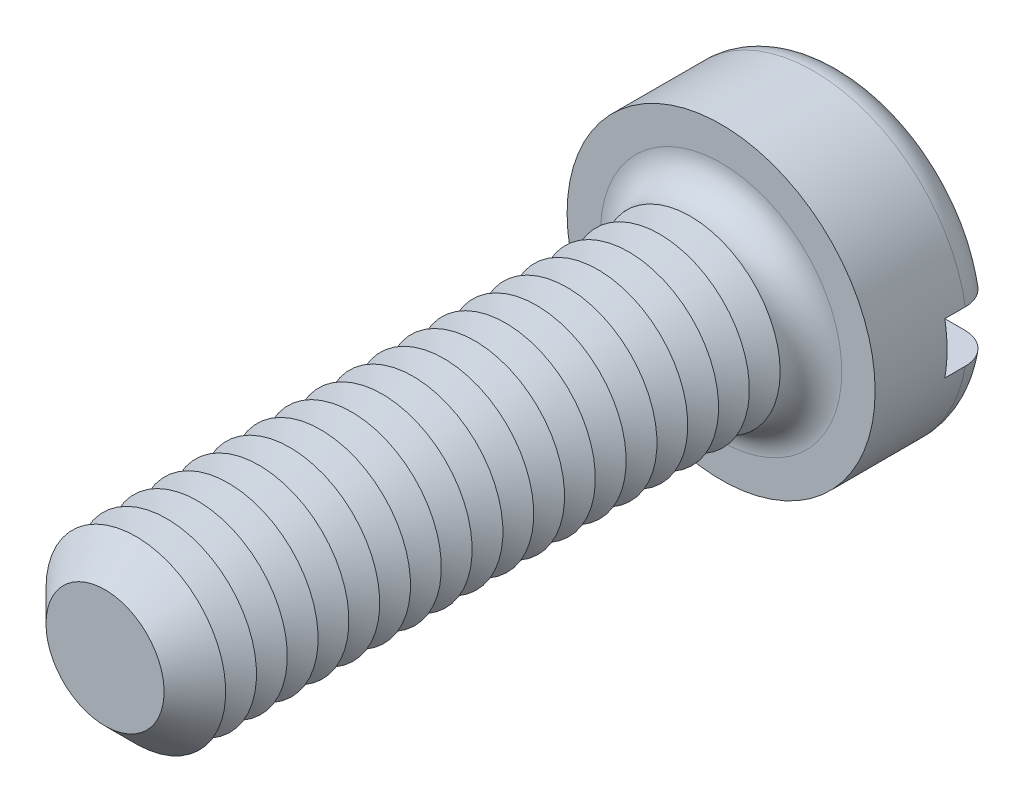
SolidWorks part; units mm, degrees
ref_plane "Front Plane" through (0, 0, 0) normal (0, 0, 1) x (1, 0, 0)
ref_plane "Top Plane" through (0, 0, 0) normal (0, 1, 0) x (1, 0, 0)
ref_plane "Right Plane" through (0, 0, 0) normal (1, 0, 0) x (0, 0, -1)
sketch "Sketch3" plane through (0, 0, 0) normal (0, 0, 1) x (1, 0, 0)
  circle A0 centre (0, 0) radius 3
  dimension "D1" = 6
extrude "Boss-Extrude2" add sketch "Sketch3" against normal blind 2.4
sketch "Sketch4" plane through (0, 0, 0) normal (0, 0, 1) x (1, 0, 0)
  circle A0 centre (0, 0) radius 1.75
  dimension "D1" = 3.5
extrude "Boss-Extrude3" add sketch "Sketch4" along normal blind 12
fillet "Fillet1" radius 0.6 2 edges at (3, 0, -2.4) (1.75, 0, 0)
chamfer "Chamfer1" distance 0.6 angle 45 1 edges at (1.75, 0, 12)
sketch "Sketch5" plane through (0, 0, 0) normal (1, 0, 0) x (0, 0, -1)
  line L0 (1.6944, 0) -> (-7.6738, 0) construction
sketch "Sketch6" plane through (0, 0, 0) normal (1, 0, 0) x (0, 0, -1)
  line L0 (-0.6, 1.75) -> (-0.9, 1.2304)
  line L1 (-0.9, 1.2304) -> (-1.2, 1.75)
  line L2 (-0.6, 1.75) -> (-11.4, 1.75) construction
  line L3 (-1.2, 1.75) -> (-0.6, 1.75)
  dimension "D1" = 0.6
revolve "Cut-Revolve1" cut sketch "Sketch6" angle 360 about L0
pattern_linear "LPattern1" count 18 spacing 0.6 along (0, 0, 1) of "Cut-Revolve1"
sketch "Sketch8" plane through (0, 0, -2.4) normal (0, 0, -1) x (-1, 0, 0)
  line L1 (3, -0.5) -> (-3, -0.5)
  line L2 (3, -0.5) -> (3, 0.5)
  line L3 (3, 0.5) -> (-3, 0.5)
  line L4 (-3, -0.5) -> (-3, 0.5)
  line L5 (3, -0.5) -> (-3, 0.5) construction
  line L6 (3, 0.5) -> (-3, -0.5) construction
  point P0 (0, 0)
  dimension "D1" = 6
  dimension "D2" = 1
extrude "Cut-Extrude1" cut sketch "Sketch8" against normal blind 1
